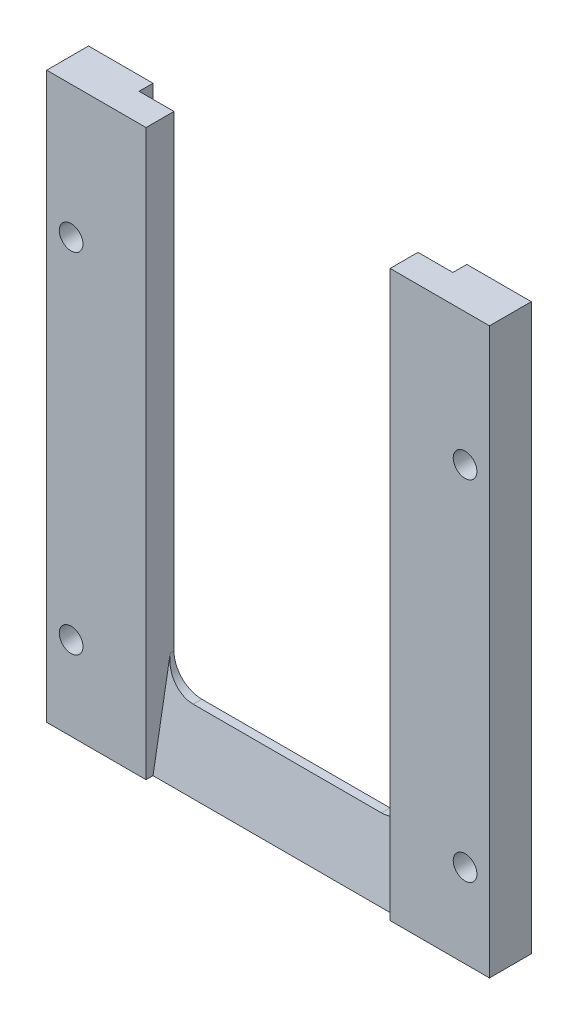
SolidWorks part; units mm, degrees
ref_plane "Front Plane" through (0, 0, 0) normal (0, 0, 1) x (1, 0, 0)
ref_plane "Top Plane" through (0, 0, 0) normal (0, 1, 0) x (1, 0, 0)
ref_plane "Right Plane" through (0, 0, 0) normal (1, 0, 0) x (0, 0, -1)
sketch "Sketch1" plane through (0, 0, 0) normal (1, 0, 0) x (0, 0, -1)
  line L0 (0, 0) -> (0, 41)
  line L1 (0, 41) -> (6, 41)
  line L2 (6, 41) -> (6, -40)
  line L3 (6, -40) -> (0, -40)
  line L4 (0, -40) -> (0, 0)
  dimension "D1" = 41
  dimension "D2" = 6
  dimension "D3" = 40
extrude "Boss-Extrude1" add sketch "Sketch1" along normal mid plane 63.5
sketch "Sketch3" plane through (0, 0, -6) normal (0, 0, -1) x (-1, 0, 0)
  line L1 (-17.5, -30) -> (17.5, -30)
  line L2 (-17.5, -30) -> (-17.5, 41)
  line L3 (-17.5, 41) -> (17.5, 41)
  line L4 (17.5, -30) -> (17.5, 41)
  point P0 (0, 0)
  dimension "D1" = 30
  dimension "D2" = 41
extrude "Cut-Extrude1" cut sketch "Sketch3" against normal through all
sketch "Sketch4" plane through (0, 0, -6) normal (0, 0, -1) x (-1, 0, 0)
  line L1 (-22.5, -34.5) -> (22.5, -34.5)
  line L2 (-22.5, -34.5) -> (-22.5, 41)
  line L3 (-22.5, 41) -> (22.5, 41)
  line L4 (22.5, -34.5) -> (22.5, 41)
  point P0 (0, 0)
  dimension "D1" = 45
  dimension "D2" = 41
  dimension "D3" = 34.5
extrude "Cut-Extrude2" cut sketch "Sketch4" against normal blind 2
sketch "Sketch8" plane through (0, 0, 0) normal (1, 0, 0) x (0, 0, -1)
  line L5 (0, -30) -> (0, -40)
  line L6 (0, -40) -> (1, -40)
  line L7 (0, -40) -> (6, -40) construction
  line L9 (3.5, -30) -> (0, -30)
  line L10 (0, -30) -> (4, -30) construction
  line L11 (1, -40) -> (3.5, -30)
  dimension "D3" = 1
  dimension "D4" = 3.5
extrude "Cut-Extrude8" [suppressed] cut sketch "Sketch8" against normal mid plane 35
sketch "Sketch10" plane through (0, 0, -6) normal (0, 0, -1) x (-1, 0, 0)
  circle A0 centre (-22.5, -34.5) radius 1.5
  circle A1 centre (22.5, -34.5) radius 1.5
  dimension "D1" = 3
  dimension "D2" = 3
extrude "Cut-Extrude9" cut sketch "Sketch10" against normal blind 2
hole_wizard "CSK for M3 Flat Head Machine Screw1" positions "Sketch14" profile "Sketch13" countersink size "M3" standard "ANSI Metric"
sketch "Sketch14" plane through (0, 0, -6) normal (0, 0, -1) x (-1, 0, 0)
  line L0 (-28.25, 22) -> (-28.25, -28) construction
  line L1 (-28.25, -28) -> (28.25, -28) construction
  line L2 (28.25, -28) -> (28.25, 22) construction
  line L3 (28.25, 22) -> (-28.25, 22) construction
  line L5 (-31.75, -40) -> (-31.75, 41) construction
  line L6 (31.75, -40) -> (31.75, 41) construction
  line L7 (-31.75, -40) -> (31.75, -40) construction
  point P0 (-28.25, -28)
  point P2 (-28.25, 22)
  point P4 (28.25, 22)
  point P6 (28.25, -28)
  dimension "D1" = 3.5
  dimension "D2" = 3.5
  dimension "D3" = 12
  dimension "D4" = 50
sketch "Sketch13" plane through (28.25, -28, -6) normal (1, 0, 0) x (0, 1, 0)
  line L0 (0, 0) -> (0, 6)
  line L1 (0, 6) -> (1.7, 6)
  line L2 (1.7, 6) -> (1.7, 1.45)
  line L3 (1.7, 1.45) -> (3.15, 0)
  line L5 (3.15, 0) -> (0, 0)
  line L6 (-1.7, 1.45) -> (-3.15, 0) construction
  line L11 (0, -6.35) -> (0, 107.95) construction
  dimension "Thru Hole Dia." = 3.4
  dimension "Thru Hole Depth" = 6
  dimension "Near C'Sink Dia." = 6.3
  dimension "Near C'Sink Angle" = 90
fillet "Fillet5" radius 4 2 edges at (-17.5, -30, -2) (17.5, -30, -2)
sketch "Sketch16" plane through (0, 0, 0) normal (1, 0, 0) x (0, 0, -1)
  line L0 (0, -40) -> (0, -25)
  line L1 (0, 41) -> (0, -40) construction
  line L2 (0, -25) -> (3.6449, -25)
  line L3 (3.6449, -25) -> (1, -40)
  line L4 (0, -40) -> (6, -40) construction
  line L5 (1, -40) -> (0, -40)
  dimension "D1" = 1
  dimension "D2" = 15
  dimension "D3" = 10
extrude "Cut-Extrude11" cut sketch "Sketch16" against normal mid plane 35
